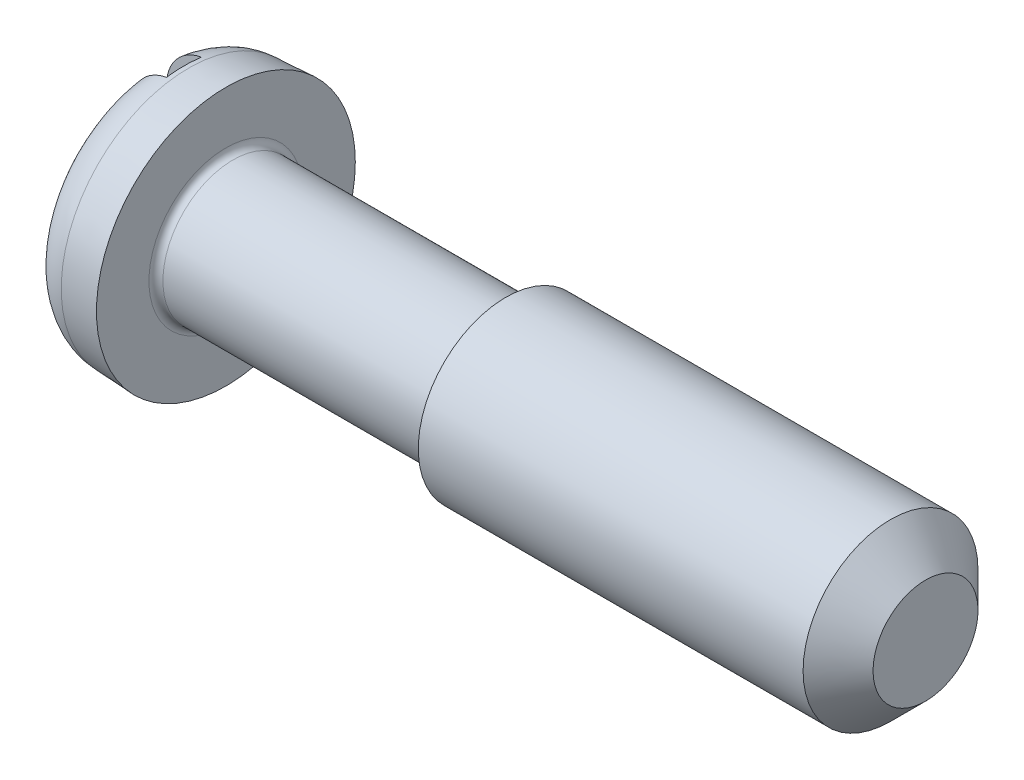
SolidWorks part; units mm, degrees
ref_plane "Front" through (0, 0, 0) normal (0, 0, 1) x (1, 0, 0)
ref_plane "Top" through (0, 0, 0) normal (0, 1, 0) x (1, 0, 0)
ref_plane "Right" through (0, 0, 0) normal (1, 0, 0) x (0, 0, -1)
other "Configuration Table"
ref_plane "Plane1" through (1.1, 0, 0) normal (1, 0, 0) x (0, 0, -1)
sketch "Sketch1" plane through (1.1, 0, 0) normal (1, 0, 0) x (0, 0, -1)
  circle A0 centre (0, 0) radius 1.85
  dimension "dk" = 3.7
extrude "BaseHead" add sketch "Sketch1" against normal blind 1.1 draft 3
sketch "Sketch2" plane through (1.1, 0.2245, -0.1603) normal (1, 0, 0) x (0, 0, -1)
  circle A0 centre (-0.1603, -0.2245) radius 1
  circle A1 centre (-0.1603, -0.2245) radius 1.85 construction
  dimension "d1" = 2
extrude "BaseBody" add sketch "Sketch2" along normal blind 10
fillet "HeadFillet" radius 0.6 1 edges at (0, 0, -1.7924)
sketch "Sketch3" plane through (-0.85, 0, 0.85) normal (0, 1, 0) x (0, 0, -1)
  line L1 (0.6, -0.85) -> (1.1, -0.85)
  line L2 (0.6, -0.85) -> (0.6, -1.35)
  line L3 (0.6, -1.35) -> (1.1, -1.35)
  line L4 (1.1, -0.85) -> (1.1, -1.35)
extrude "Slot" cut sketch "Sketch3" against normal through all and the other way through all
sketch "Sketch4" plane through (11.1, -0.1571, -0.7581) normal (1, 0, 0) x (0, 0, -1)
  circle A0 centre (-0.7581, 0.1571) radius 1.25
  circle A1 centre (-0.7581, 0.1571) radius 1 construction
extrude "BaseEnd" add sketch "Sketch4" against normal blind 6
chamfer "Chamfer1" distance 0.5 angle 45 1 edges at (11.1, 0, -1.25)
fillet "Fillet1" radius 0.1 2 edges at (1.1, 0, -1) (5.1, 0, -1)
sketch "Sketch5" plane through (0, 0, 0) normal (0, 0, 1) x (1, 0, 0)
  line L0 (5.1, 0.9252) -> (5.2875, 1.25)
  line L1 (5.2875, 1.25) -> (5.2875, 1.625)
  line L2 (5.2875, 1.625) -> (4.9125, 1.625)
  line L3 (4.9125, 1.625) -> (4.9125, 1.25)
  line L4 (4.9125, 1.25) -> (5.1, 0.9252)
  line L6 (5.1, 1.25) -> (5.1, -1.25) construction
  line L7 (0, 0) -> (6.6036, 0) construction
  line L8 (0, 1.1971) -> (0, -1.1971) construction
revolve "Cut-Revolve10" [suppressed] cut sketch "Sketch5" angle 360 about L7
pattern_linear "LPattern10" [suppressed] count 13 spacing 0.45 along (1, 0, 0)
equation "\"m@Sketch3\" = \"n@Sketch3\" / 2"
equation "\"D1@Plane1\"=\"k@BaseHead\""
equation "\"D1@Sketch5\" = \"d@Sketch4\""
equation "\"D2@Sketch5\" =  ( \"d@Sketch4\" - \"THD_MINOR@ThreadCosmetic1\" )  / 2"
equation "\"D3@LPattern10\" = \"D2@Sketch5\" * 1.2"
equation "\"D1@LPattern10\" = \"b@BaseEnd\" / \"D3@LPattern10\""
